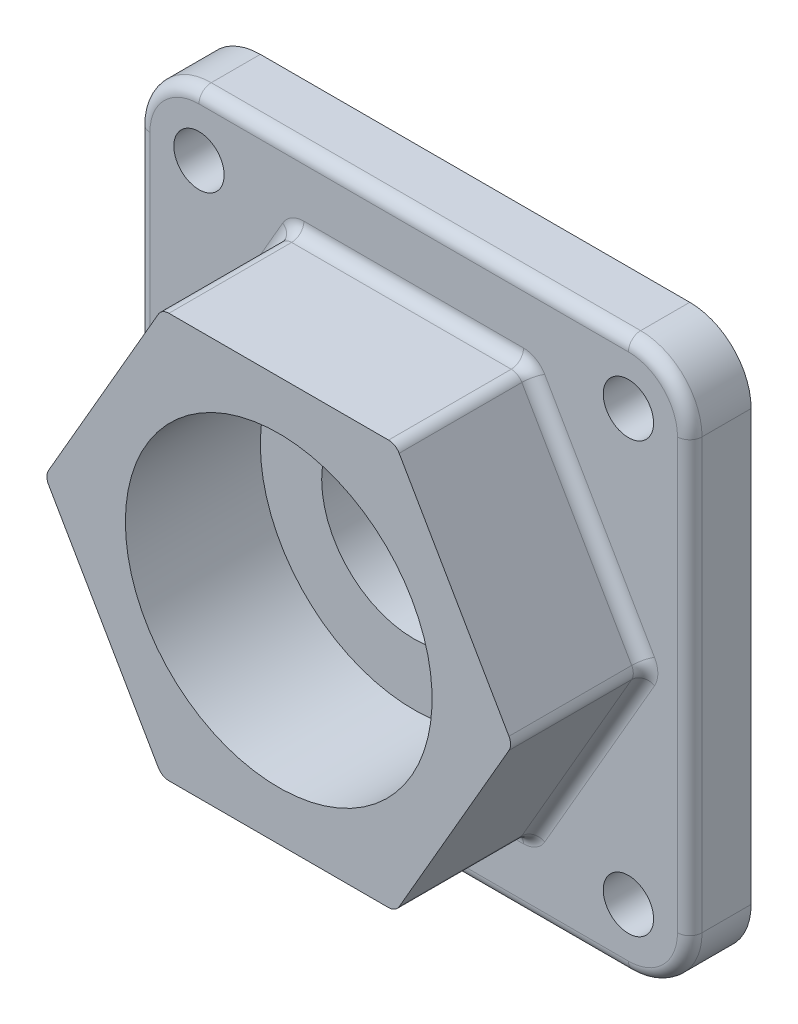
SolidWorks part; units mm, degrees
ref_plane "Front" through (0, 0, 0) normal (0, 0, 1) x (1, 0, 0)
ref_plane "Top" through (0, 0, 0) normal (0, 1, 0) x (1, 0, 0)
ref_plane "Right" through (0, 0, 0) normal (1, 0, 0) x (0, 0, -1)
sketch "Sketch1" plane through (0, 0, 0) normal (0, 0, 1) x (1, 0, 0)
  line L1 (-35, 45) -> (35, 45)
  line L2 (-45, 35) -> (-45, -35)
  line L3 (-35, -45) -> (35, -45)
  line L4 (45, 35) -> (45, -35)
  line L5 (-45, 45) -> (45, -45) construction
  line L6 (-45, -45) -> (45, 45) construction
  arc A0 (35, -45) -> (45, -35) centre (35, -35) ccw
  arc A1 (-45, -35) -> (-35, -45) centre (-35, -35) ccw
  arc A2 (35, 45) -> (45, 35) centre (35, 35) cw
  arc A3 (-35, 45) -> (-45, 35) centre (-35, 35) ccw
  point P0 (0, 0)
  dimension "D2" = 10
  dimension "D1" = 90
extrude "Boss-Extrude1" add sketch "Sketch1" along normal mid plane 10
sketch "Sketch2" plane through (0, 0, 5) normal (0, 0, 1) x (1, 0, 0)
  line L1 (19.0526, -33) -> (38.1051, 0)
  line L2 (38.1051, 0) -> (19.0526, 33)
  line L3 (19.0526, 33) -> (-19.0526, 33)
  line L4 (-19.0526, 33) -> (-38.1051, 0)
  line L5 (-38.1051, 0) -> (-19.0526, -33)
  line L6 (-19.0526, -33) -> (19.0526, -33)
  circle A0 centre (0, 0) radius 33 construction
  dimension "D1" = 66
extrude "Boss-Extrude2" add sketch "Sketch2" along normal blind 22
sketch "Sketch3" plane through (0, 0, -5) normal (0, 0, -1) x (-1, 0, 0)
  circle A0 centre (0, 0) radius 32.5
  dimension "D1" = 65
extrude "Boss-Extrude3" add sketch "Sketch3" along normal blind 2.5
sketch "Sketch4" plane through (0, 0, -7.5) normal (0, 0, -1) x (-1, 0, 0)
  circle A0 centre (0, 0) radius 27.5
  dimension "D1" = 55
extrude "Boss-Extrude4" add sketch "Sketch4" along normal blind 13
sketch "Sketch5" plane through (0, 0, 0) normal (0, 1, 0) x (1, 0, 0)
  line L0 (-25, -27) -> (-25, -5)
  line L1 (-19.0526, -27) -> (-38.1051, -27) construction
  line L2 (35, -5) -> (-35, -5) construction
  line L3 (-25, -5) -> (-15, -5)
  line L4 (19.0526, -5) -> (-19.0526, -5) construction
  line L5 (-15, -5) -> (-15, 14)
  line L6 (0, 20.5) -> (-22.8142, 20.5)
  line L7 (0, 39.2659) -> (0, -45.2061) construction
  line L8 (27.5, 20.5) -> (-27.5, 20.5) construction
  line L9 (27.5, 20.5) -> (-27.5, 20.5) construction
  line L11 (0, 20.5) -> (0, -27)
  line L12 (19.0526, -27) -> (-19.0526, -27) construction
  line L13 (0, -27) -> (-25, -27)
  arc A0 (-22.8142, 20.5) -> (-15, 14) centre (0, 39.98) ccw
  dimension "D1" = 25.98
  dimension "D5" = 59.9987
  dimension "D2" = 50
  dimension "D3" = 30
  dimension "D4" = 19
revolve "Cut-Revolve1" cut sketch "Sketch5" angle 360 about L7
fillet "Fillet1" radius 2 20 edges at (28.5788, -16.5, 5) (28.5788, 16.5, 5) (0, -33, 5) (0, 33, 5) (-28.5788, -16.5, 5) (-42.0711, 42.0711, 5) (0, 45, 5) (42.0711, 42.0711, 5) (45, 0, 5) (42.0711, -42.0711, 5) (0, -45, 5) (-42.0711, -42.0711, 5) (-28.5788, 16.5, 5) (-38.1051, 0, 16) (-19.0526, -33, 16) (19.0526, -33, 16) (38.1051, 0, 16) (19.0526, 33, 16) (-19.0526, 33, 16) (-45, 0, 5)
hole_wizard "Ø8.2 (8.2) Diameter Hole1" positions "Sketch7" profile "Sketch8" hole size "Ø8.2" standard "ANSI Metric"
sketch "Sketch7" plane through (0, 0, 5) normal (0, 0, 1) x (1, 0, 0)
  arc A0 (-43, -35) -> (-35, -43) centre (-35, -35) ccw construction
  arc A1 (-35, 43) -> (-43, 35) centre (-35, 35) ccw construction
  arc A2 (35, -43) -> (43, -35) centre (35, -35) ccw construction
  arc A5 (43, 35) -> (35, 43) centre (35, 35) ccw construction
  point P0 (-35, 35)
  point P2 (35, 35)
  point P4 (35, -35)
  point P6 (-35, -35)
sketch "Sketch8" plane through (-35, 35, 5) normal (1, 0, 0) x (0, -1, 0)
  line L0 (0, 0) -> (0, 25.5)
  line L1 (0, 25.5) -> (4.1, 25.5)
  line L2 (4.1, 25.5) -> (4.1, 0)
  line L5 (4.1, 0) -> (0, 0)
  line L11 (0, -6.35) -> (0, 107.95) construction
  dimension "Thru Hole Dia." = 8.2
  dimension "Thru Hole Depth" = 25.5
